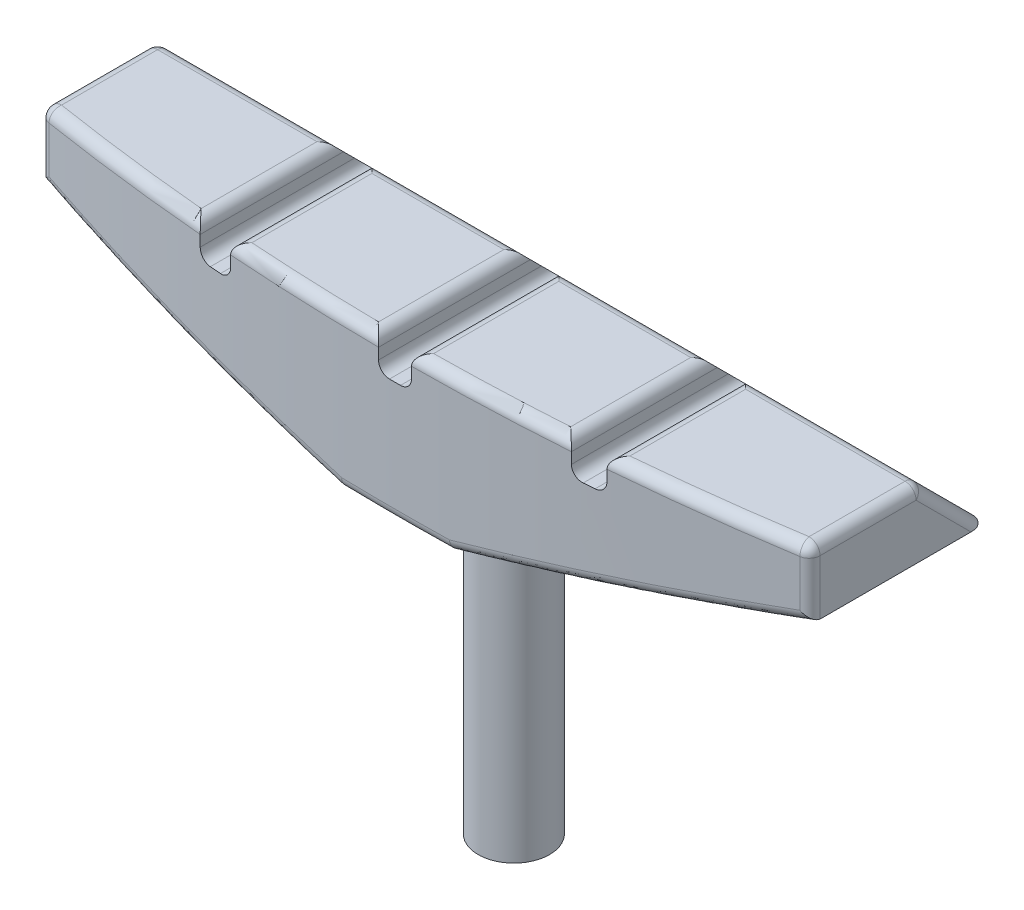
SolidWorks part; units mm, degrees
ref_plane "Piano frontale" through (0, 0, 0) normal (0, 0, 1) x (1, 0, 0)
ref_plane "Piano superiore" through (0, 0, 0) normal (0, 1, 0) x (1, 0, 0)
ref_plane "Piano destro" through (0, 0, 0) normal (1, 0, 0) x (0, 0, -1)
sketch "Schizzo1" plane through (0, 0, 0) normal (0, 0, 1) x (1, 0, 0)
  line L0 (5, 0) -> (-5, 0)
  line L1 (-5, 0) -> (-35, 8)
  line L2 (0, -12.9873) -> (0, 28.2403) construction
  line L3 (-35, 8) -> (-35, 14)
  line L4 (-35, 14) -> (-18.5, 14)
  line L5 (1.5, 11) -> (-1.5, 11)
  line L6 (-1.5, 11) -> (-1.5, 14)
  line L7 (-15.5, 14) -> (-15.5, 11)
  line L8 (-15.5, 11) -> (-18.5, 11)
  line L9 (-18.5, 11) -> (-18.5, 14)
  line L10 (-15.5, 14) -> (-1.5, 14)
  line L11 (15.5, 14) -> (1.5, 14)
  line L12 (18.5, 11) -> (18.5, 14)
  line L13 (15.5, 11) -> (18.5, 11)
  line L14 (15.5, 14) -> (15.5, 11)
  line L15 (1.5, 11) -> (1.5, 14)
  line L16 (35, 14) -> (18.5, 14)
  line L17 (35, 8) -> (35, 14)
  line L18 (5, 0) -> (35, 8)
  point P20 (0, 11)
  point P23 (0, 0)
  dimension "D2" = 6
  dimension "D3" = 8
  dimension "D4" = 5
  dimension "D5" = 1.5
  dimension "D6" = 3
  dimension "D7" = 14
extrude "Estrusione1" add sketch "Schizzo1" along normal blind 16
sketch "Schizzo4" plane through (0, 14, 0) normal (0, 1, 0) x (-1, 0, 0)
  line L0 (-35, 16) -> (35, 16)
  arc A0 (35, 16) -> (-35, 16) centre (0, -200.1851) ccw
  dimension "D1" = 438
extrude "Estrusione3" add sketch "Schizzo4" against normal up to surface (14 mm away)
sketch "Schizzo5" plane through (0, 0, 16) normal (0, 0, -1) x (-1, 0, 0)
  line L0 (-5, 0) -> (-35, 8) construction
  line L1 (35, 8) -> (5, 0) construction
  line L2 (-5, 0) -> (-35, 8)
  line L3 (35, 8) -> (5, 0)
  line L4 (-35, 8) -> (-35, -8.6263)
  line L5 (35, 8) -> (35, -8.6263)
  line L6 (-35, -8.6263) -> (35, -8.6263)
  line L7 (-5, 0) -> (5, 0)
  line L8 (-15.5, 11) -> (-15.5, 14) construction
  line L9 (1.5, 11) -> (1.5, 14) construction
  line L10 (18.5, 11) -> (18.5, 14) construction
  line L11 (15.5, 11) -> (18.5, 11) construction
  line L12 (15.5, 14) -> (15.5, 11) construction
  line L13 (-1.5, 11) -> (1.5, 11) construction
  line L14 (-1.5, 14) -> (-1.5, 11) construction
  line L15 (-18.5, 11) -> (-15.5, 11) construction
  line L16 (-18.5, 14) -> (-18.5, 11) construction
  line L17 (-15.5, 11) -> (-15.5, 14)
  line L18 (1.5, 11) -> (1.5, 14)
  line L19 (18.5, 11) -> (18.5, 14)
  line L20 (15.5, 11) -> (18.5, 11)
  line L21 (15.5, 14) -> (15.5, 11)
  line L22 (-1.5, 11) -> (1.5, 11)
  line L23 (-1.5, 14) -> (-1.5, 11)
  line L24 (-18.5, 11) -> (-15.5, 11)
  line L25 (-18.5, 14) -> (-18.5, 11)
  line L26 (-18.5, 14) -> (-15.5, 14)
  line L27 (-1.5, 14) -> (1.5, 14)
  line L28 (15.5, 14) -> (18.5, 14)
extrude "Taglio-Estrusione1" cut sketch "Schizzo5" against normal through all
chamfer "Smusso1" distance 6 angle 45 1 edges at (26.75, 14, 0)
fillet "Raccordo1" radius 1 32 edges at (20, 4, 0) (0, 0, 0) (-20, 4, 0) (8.5, 14, 6) (26.75, 14, 6) (-8.5, 14, 6) (-26.75, 14, 6) (-35, 14, 11) (35, 14, 11) (18.5, 14, 12.0161) (15.5, 14, 12.1328) (1.5, 14, 12.4049) (-1.5, 14, 12.4049) (-15.5, 14, 12.1328) (-18.5, 14, 12.0161) (18.5, 11, 10.5161) (15.5, 11, 10.6328) (1.5, 11, 10.9049) (-1.5, 11, 10.9049) (-15.5, 11, 10.6328) (-18.5, 11, 10.5161) (-20.0475, 4.0127, 17.8954) (0, 0, 18.8149) (20.0475, 4.0127, 17.8954) (35, 11, 3) (35, 11, 16) (-35, 11, 3) (-35, 11, 16) (-26.7693, 14, 17.1727) (-8.5044, 14, 18.6497) (8.5044, 14, 18.6497) (26.7693, 14, 17.1727)
sketch "Schizzo2" plane through (0, 0, 0) normal (0, -1, 0) x (1, 0, 0)
  circle A0 centre (0, 8) radius 3.25
  dimension "D1" = 6.5
extrude "Estrusione2" add sketch "Schizzo2" along normal blind 30 separate body
